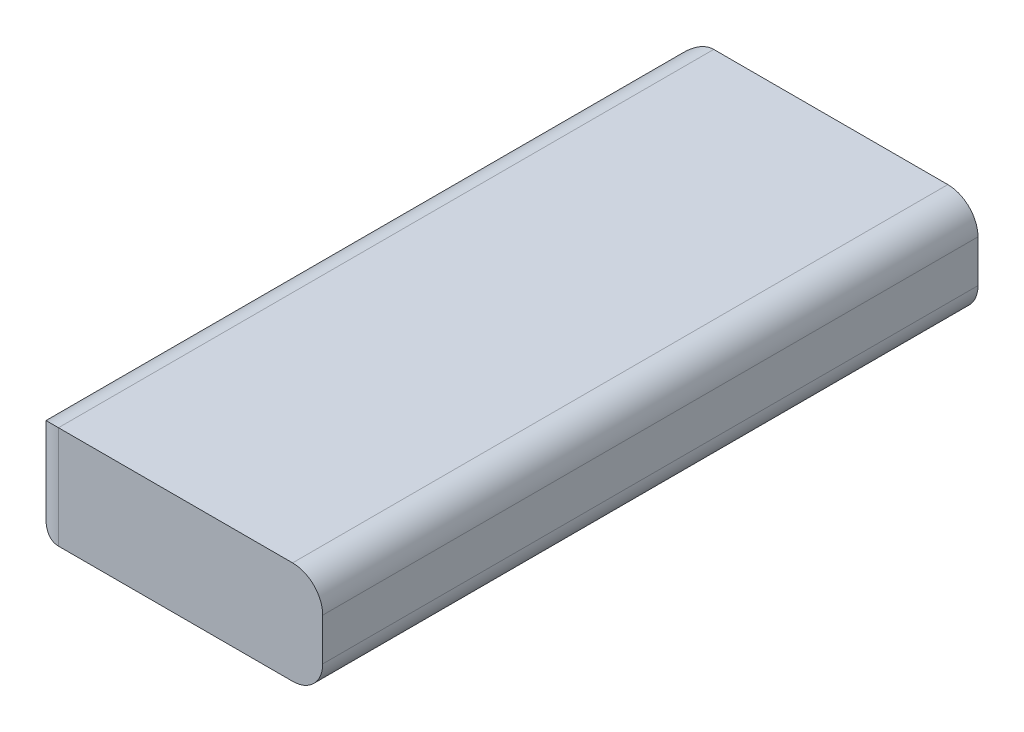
SolidWorks part; units mm, degrees
ref_plane "Front Plane" through (0, 0, 0) normal (0, 0, 1) x (1, 0, 0)
ref_plane "Top Plane" through (0, 0, 0) normal (0, 1, 0) x (1, 0, 0)
ref_plane "Right Plane" through (0, 0, 0) normal (1, 0, 0) x (0, 0, -1)
sketch "Sketch1" plane through (0, 0, 0) normal (0, 0, 1) x (1, 0, 0)
  line L1 (6.35, 0) -> (55.626, 0)
  line L2 (0, 6.35) -> (0, 15.24)
  line L3 (6.35, 21.59) -> (55.626, 21.59)
  line L4 (61.976, 6.35) -> (61.976, 15.24)
  arc A0 (0, 15.24) -> (6.35, 21.59) centre (6.35, 15.24) cw
  arc A1 (6.35, 0) -> (0, 6.35) centre (6.35, 6.35) cw
  arc A2 (55.626, 0) -> (61.976, 6.35) centre (55.626, 6.35) ccw
  arc A3 (55.626, 21.59) -> (61.976, 15.24) centre (55.626, 15.24) cw
  point P7 (0, 21.59)
  point P10 (0, 0)
  point P15 (61.976, 21.59)
  dimension "D3" = 6.35
  dimension "D1" = 21.59
  dimension "D2" = 61.976
extrude "Boss-Extrude1" add sketch "Sketch1" along normal blind 137.922
sketch "Sketch2" plane through (0, 21.59, 0) normal (0, 1, 0) x (1, 0, 0)
  line L0 (0, -137.922) -> (0, -131.572)
  line L1 (0, -137.922) -> (0, 0) construction
  line L2 (0, -137.922) -> (6.35, -137.922)
  line L3 (0, 0) -> (-0.0164, -6.35)
  line L4 (0, 0) -> (6.35, 0)
  arc A0 (0, -131.572) -> (6.35, -137.922) centre (6.35, -131.572) ccw
  arc A1 (6.35, 0) -> (-0.0164, -6.35) centre (6.35, -6.3665) ccw
  dimension "D1" = 6.35
  dimension "D2" = 6.35
extrude "Cut-Extrude1" cut sketch "Sketch2" against normal through all
